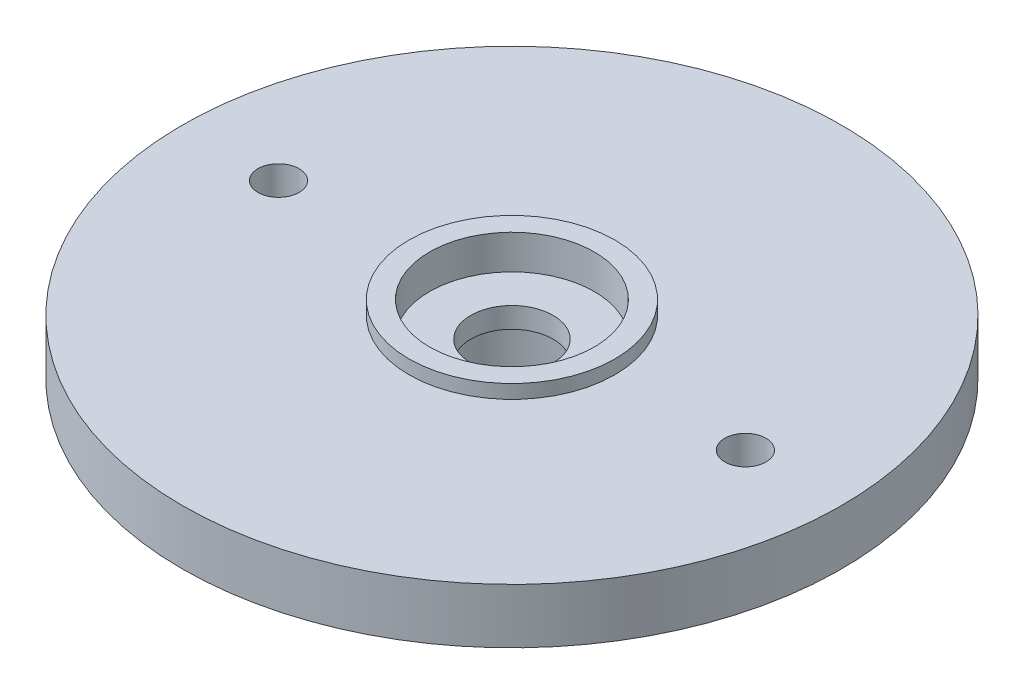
SolidWorks part; units mm, degrees
ref_plane "Přední" through (0, 0, 0) normal (0, 0, 1) x (1, 0, 0)
ref_plane "Horní" through (0, 0, 0) normal (0, 1, 0) x (1, 0, 0)
ref_plane "Pravá" through (0, 0, 0) normal (1, 0, 0) x (0, 0, -1)
sketch "Skica1" plane through (0, 0, 0) normal (0, 0, 1) x (1, 0, 0)
  line L0 (0, 9.5609) -> (0, -3.8281) construction
  line L1 (3, 0) -> (4.5, 0)
  line L2 (4.5, 0) -> (4.5, 2.5)
  line L3 (4.5, 2.5) -> (12, 2.5)
  line L4 (12, 2.5) -> (12, 4.5)
  line L5 (12, 4.5) -> (3.75, 4.5)
  line L6 (3.75, 4.5) -> (3.75, 5)
  line L7 (3.75, 5) -> (3, 5)
  line L8 (3, 5) -> (3, 3.75)
  line L9 (3, 3.75) -> (1.5, 3.75)
  line L10 (1.5, 3.75) -> (1.5, 3)
  line L11 (1.5, 3) -> (3, 3)
  line L12 (3, 3) -> (3, 0)
  dimension "D1" = 3
  dimension "D2" = 6
  dimension "D3" = 6
  dimension "D4" = 9
  dimension "D5" = 7.5
  dimension "D6" = 24
  dimension "D7" = 2
  dimension "D8" = 1.25
  dimension "D9" = 5
  dimension "D10" = 4.5
  dimension "D11" = 3
revolve "Základ-Rotační" add sketch "Skica1" angle 360 about L0
sketch "Skica2" plane through (0, 4.5, 0) normal (0, 1, 0) x (-1, 0, 0)
  line L0 (-10.5955, 0) -> (10.9916, 0) construction
  line L1 (0, -10.1252) -> (0, 9.0359) construction
  circle A0 centre (-8.5, 0) radius 0.75
  circle A1 centre (8.5, 0) radius 0.75
  dimension "D1" = 17
  dimension "D2" = 1.5
extrude "Odebrat vysunutím1" cut sketch "Skica2" against normal through all
